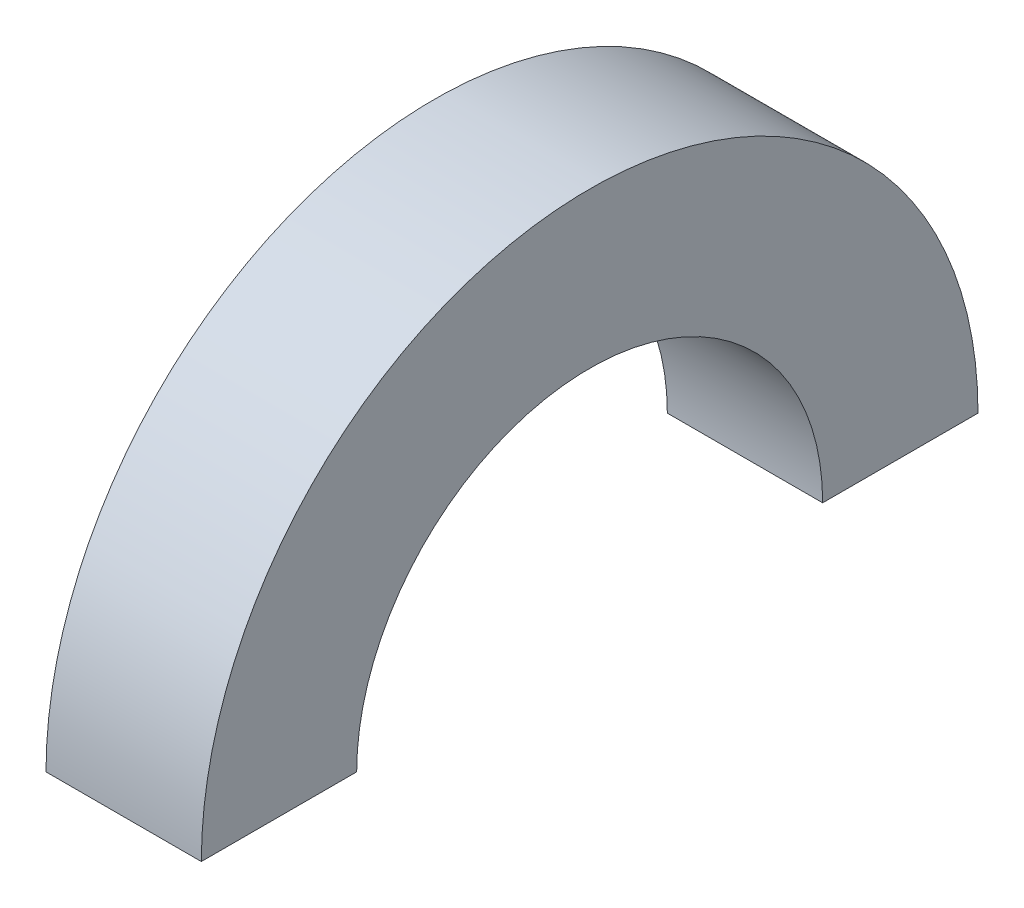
SolidWorks part; units mm, degrees
ref_plane "Front Plane" through (0, 0, 0) normal (0, 0, 1) x (1, 0, 0)
ref_plane "Top Plane" through (0, 0, 0) normal (0, 1, 0) x (1, 0, 0)
ref_plane "Right Plane" through (0, 0, 0) normal (1, 0, 0) x (0, 0, -1)
sketch "Sketch2" plane through (0, 0, 0) normal (1, 0, 0) x (0, 0, -1)
  arc A0 (0, 0) -> (100, 0) centre (50, 0) cw
  dimension "D1" = 50
sketch "Sketch3" plane through (0, 0, 0) normal (0, 1, 0) x (1, 0, 0)
  line L1 (20, 0) -> (0, 0)
  line L2 (20, 0) -> (20, 20)
  line L3 (20, 20) -> (0, 20)
  line L4 (0, 0) -> (0, 20)
  dimension "D1" = 20
  dimension "D2" = 20
sweep "Sweep1" add profiles "Sketch3" path "Sketch2"
